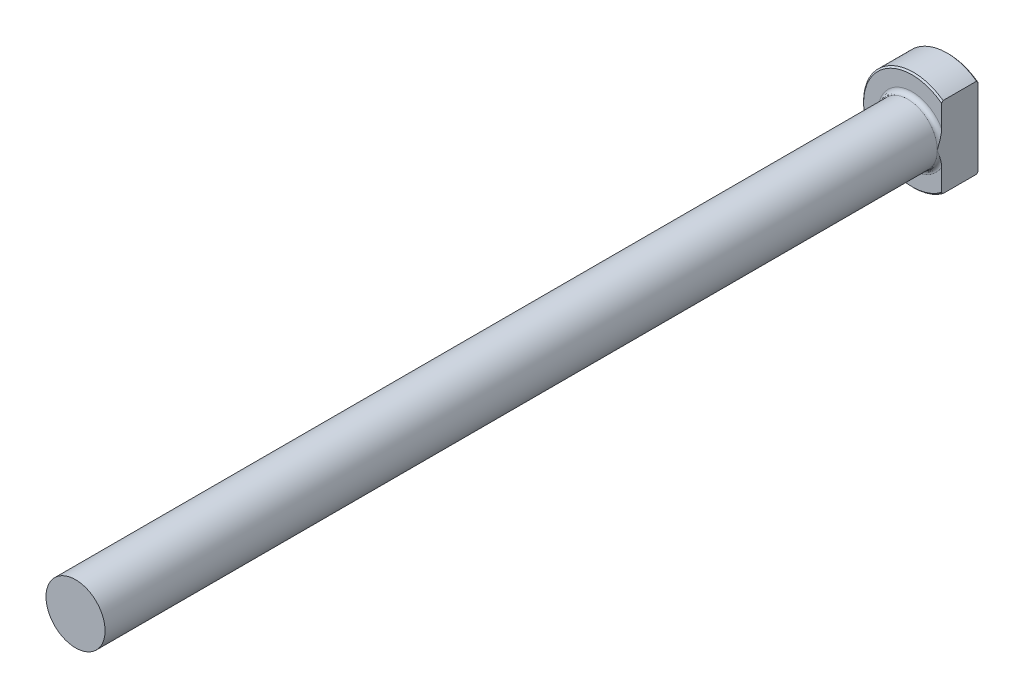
SolidWorks part; units mm, degrees
ref_plane "Front Plane" through (0, 0, 0) normal (0, 0, 1) x (1, 0, 0)
ref_plane "Top Plane" through (0, 0, 0) normal (0, 1, 0) x (1, 0, 0)
ref_plane "Right Plane" through (0, 0, 0) normal (1, 0, 0) x (0, 0, -1)
sketch "Sketch1" plane through (0, 0, 0) normal (1, 0, 0) x (0, 0, -1)
  line L0 (0, 0) -> (0, 8.7249)
  line L1 (0, 8.7249) -> (-6.35, 8.7249)
  line L2 (-6.35, 8.7249) -> (-6.35, 5.9207)
  line L3 (-7.112, 5.1587) -> (-152.4, 5.1587)
  line L4 (-152.4, 5.1587) -> (-152.4, 0)
  line L5 (-152.4, 0) -> (0, 0)
  line L6 (25.4347, 0) -> (-130.6739, 0) construction
  arc A0 (-6.35, 5.9207) -> (-7.112, 5.1587) centre (-7.112, 5.9207) cw
  dimension "D4" = 0.762
  dimension "D1" = 10.3175
  dimension "D2" = 17.4498
  dimension "D3" = 6.35
  dimension "D5" = 152.4
revolve "Revolve1" add sketch "Sketch1" angle 360 about L6
chamfer "Chamfer1" distance 0.254 angle 45 2 edges at (-8.7249, 0, 0) (-8.7249, 0, 6.35)
sketch "Sketch2" plane through (0, 0, 0) normal (0, 0, -1) x (-1, 0, 0)
  line L1 (-5.1587, 7.0364) -> (-5.1587, -7.0364)
  circle A1 centre (0, 0) radius 8.7249 construction
  circle A2 centre (0, 0) radius 5.1587 construction
  arc A5 (-5.1587, -7.0364) -> (-5.1587, 7.0364) centre (0, 0) cw
extrude "Cut-Extrude1" cut sketch "Sketch2" against normal up to next
